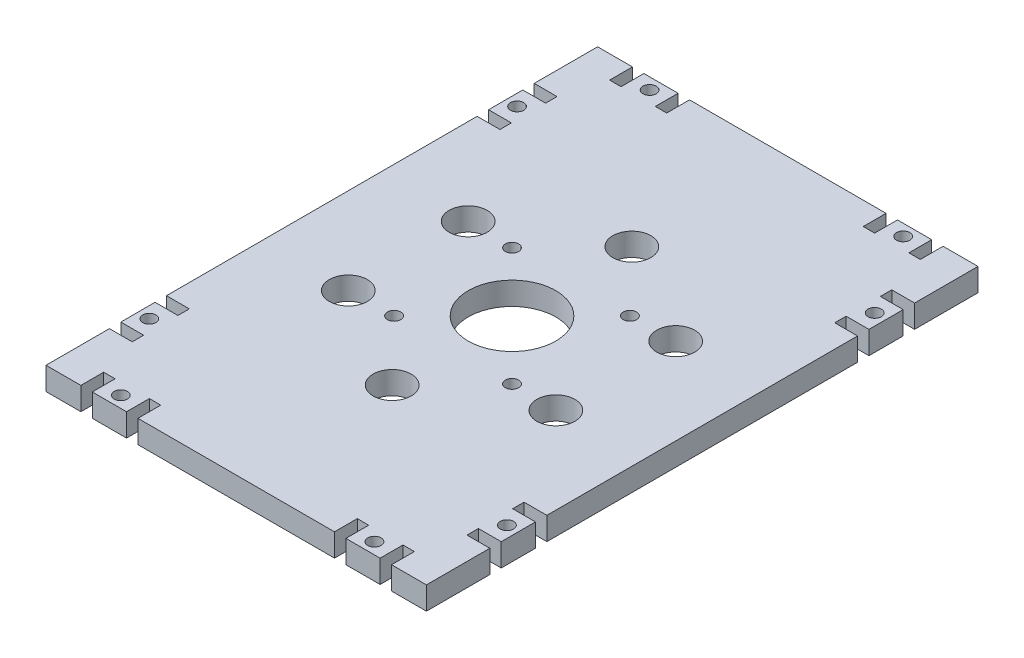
SolidWorks part; units mm, degrees
ref_plane "Front Plane" through (0, 0, 0) normal (0, 0, 1) x (1, 0, 0)
ref_plane "Top Plane" through (0, 0, 0) normal (0, 1, 0) x (1, 0, 0)
ref_plane "Right Plane" through (0, 0, 0) normal (1, 0, 0) x (0, 0, -1)
sketch "Sketch1" plane through (0, 0, 0) normal (0, 1, 0) x (1, 0, 0)
  line L1 (-50, -72.5) -> (50, -72.5)
  line L2 (-50, -72.5) -> (-50, 72.5)
  line L3 (-50, 72.5) -> (50, 72.5)
  line L4 (50, -72.5) -> (50, 72.5)
  line L5 (-50, -72.5) -> (50, 72.5) construction
  line L6 (-50, 72.5) -> (50, -72.5) construction
  point P0 (0, 0)
  dimension "D1" = 100
  dimension "D2" = 145
extrude "Boss-Extrude1" add sketch "Sketch1" along normal blind 6
sketch "Sketch2" plane through (0, 6, 0) normal (0, 1, 0) x (1, 0, 0)
  line L0 (50, 69.5) -> (-50, 69.5) construction
  line L1 (-50, -69.5) -> (50, -69.5) construction
  line L2 (-47, 72.5) -> (-47, -72.5) construction
  line L3 (50, 66.5) -> (-50, 66.5) construction
  line L4 (47, -72.5) -> (47, 72.5) construction
  line L5 (-44, 72.5) -> (-44, -72.5) construction
  line L6 (44, -72.5) -> (44, 72.5) construction
  line L7 (-50, -66.5) -> (50, -66.5) construction
  line L12 (50, -72.5) -> (50, 72.5)
  line L13 (50, 72.5) -> (-50, 72.5)
  line L14 (-50, 72.5) -> (-50, -72.5)
  line L15 (-50, -72.5) -> (50, -72.5)
  line L16 (50, -72.5) -> (50, 72.5) construction
  line L17 (50, 72.5) -> (-50, 72.5) construction
  line L18 (-50, 72.5) -> (-50, -72.5) construction
  line L19 (-50, -72.5) -> (50, -72.5) construction
  line L21 (-50, 55.8333) -> (-44, 55.8333)
  line L22 (-50, 55.8333) -> (-50, 52.8333)
  line L23 (-50, 52.8333) -> (-44, 52.8333)
  line L24 (-44, 55.8333) -> (-44, 52.8333)
  line L25 (-33.3333, 69.5) -> (-33.3333, 66.5) construction
  line L26 (-40.8333, 66.5) -> (-37.8333, 66.5)
  line L27 (-40.8333, 66.5) -> (-40.8333, 72.5)
  line L28 (-40.8333, 72.5) -> (-37.8333, 72.5)
  line L29 (-37.8333, 66.5) -> (-37.8333, 72.5)
  line L30 (-47, 48.3333) -> (-44, 48.3333) construction
  line L31 (0, 72.5) -> (0, 0) construction
  line L32 (0, 0) -> (-50, 0) construction
  line L33 (-25.8333, 72.5) -> (-28.8333, 72.5)
  line L34 (-28.8333, 66.5) -> (-28.8333, 72.5)
  line L35 (-25.8333, 66.5) -> (-28.8333, 66.5)
  line L36 (-25.8333, 66.5) -> (-25.8333, 72.5)
  line L37 (-50, 43.8333) -> (-44, 43.8333)
  line L38 (-44, 40.8333) -> (-44, 43.8333)
  line L39 (-50, 40.8333) -> (-44, 40.8333)
  line L40 (-50, 40.8333) -> (-50, 43.8333)
  line L41 (50, 40.8333) -> (50, 43.8333)
  line L42 (50, 40.8333) -> (44, 40.8333)
  line L43 (44, 40.8333) -> (44, 43.8333)
  line L44 (50, 43.8333) -> (44, 43.8333)
  line L45 (50, 52.8333) -> (44, 52.8333)
  line L46 (44, 55.8333) -> (44, 52.8333)
  line L47 (50, 55.8333) -> (44, 55.8333)
  line L48 (50, 55.8333) -> (50, 52.8333)
  line L49 (40.8333, 72.5) -> (37.8333, 72.5)
  line L50 (37.8333, 66.5) -> (37.8333, 72.5)
  line L51 (40.8333, 66.5) -> (37.8333, 66.5)
  line L52 (40.8333, 66.5) -> (40.8333, 72.5)
  line L53 (25.8333, 66.5) -> (25.8333, 72.5)
  line L54 (25.8333, 66.5) -> (28.8333, 66.5)
  line L55 (28.8333, 66.5) -> (28.8333, 72.5)
  line L56 (25.8333, 72.5) -> (28.8333, 72.5)
  line L57 (50, -40.8333) -> (44, -40.8333)
  line L58 (44, -40.8333) -> (44, -43.8333)
  line L59 (50, -43.8333) -> (44, -43.8333)
  line L60 (50, -40.8333) -> (50, -43.8333)
  line L61 (50, -55.8333) -> (50, -52.8333)
  line L62 (50, -55.8333) -> (44, -55.8333)
  line L63 (44, -55.8333) -> (44, -52.8333)
  line L64 (50, -52.8333) -> (44, -52.8333)
  line L65 (40.8333, -66.5) -> (40.8333, -72.5)
  line L66 (40.8333, -66.5) -> (37.8333, -66.5)
  line L67 (37.8333, -66.5) -> (37.8333, -72.5)
  line L68 (40.8333, -72.5) -> (37.8333, -72.5)
  line L69 (25.8333, -66.5) -> (28.8333, -66.5)
  line L70 (28.8333, -66.5) -> (28.8333, -72.5)
  line L71 (25.8333, -72.5) -> (28.8333, -72.5)
  line L72 (25.8333, -66.5) -> (25.8333, -72.5)
  line L73 (-50, -40.8333) -> (-50, -43.8333)
  line L74 (-50, -40.8333) -> (-44, -40.8333)
  line L75 (-44, -40.8333) -> (-44, -43.8333)
  line L76 (-50, -43.8333) -> (-44, -43.8333)
  line L77 (-50, -52.8333) -> (-44, -52.8333)
  line L78 (-44, -55.8333) -> (-44, -52.8333)
  line L79 (-50, -55.8333) -> (-44, -55.8333)
  line L80 (-50, -55.8333) -> (-50, -52.8333)
  line L81 (-40.8333, -72.5) -> (-37.8333, -72.5)
  line L82 (-37.8333, -66.5) -> (-37.8333, -72.5)
  line L83 (-40.8333, -66.5) -> (-37.8333, -66.5)
  line L84 (-40.8333, -66.5) -> (-40.8333, -72.5)
  line L85 (-25.8333, -66.5) -> (-25.8333, -72.5)
  line L86 (-25.8333, -66.5) -> (-28.8333, -66.5)
  line L87 (-28.8333, -66.5) -> (-28.8333, -72.5)
  line L88 (-25.8333, -72.5) -> (-28.8333, -72.5)
  circle A0 centre (-33.3333, 69.5) radius 1.75
  circle A1 centre (-47, 48.3333) radius 1.75
  circle A2 centre (47, 48.3333) radius 1.75
  circle A3 centre (33.3333, 69.5) radius 1.75
  circle A4 centre (47, -48.3333) radius 1.75
  circle A5 centre (33.3333, -69.5) radius 1.75
  circle A6 centre (-47, -48.3333) radius 1.75
  circle A7 centre (-33.3333, -69.5) radius 1.75
  point P38 (-39.3333, 66.5)
  point P39 (-44, 54.3333)
extrude "Cut-Extrude1" cut sketch "Sketch2" against normal through all
sketch "Sketch3" plane through (0, 6, 0) normal (0, 1, 0) x (1, 0, 0)
  line L2 (-15.5, -15.5) -> (15.5, -15.5) construction
  line L3 (-15.5, -15.5) -> (-15.5, 15.5) construction
  line L4 (-15.5, 15.5) -> (15.5, 15.5) construction
  line L5 (15.5, -15.5) -> (15.5, 15.5) construction
  line L6 (-15.5, -15.5) -> (15.5, 15.5) construction
  line L7 (-15.5, 15.5) -> (15.5, -15.5) construction
  circle A0 centre (0, 0) radius 11.5
  circle A1 centre (15.5, 15.5) radius 1.75
  circle A2 centre (-15.5, 15.5) radius 1.75
  circle A3 centre (-15.5, -15.5) radius 1.75
  circle A4 centre (15.5, -15.5) radius 1.75
  dimension "D1" = 31
  dimension "D2" = 23
  dimension "D4" = 3.5
extrude "Cut-Extrude2" cut sketch "Sketch3" against normal through all
sketch "Sketch4" plane through (0, 0, 0) normal (1, 0, 0) x (0, 0, -1)
  line L0 (-35, 7.7916) -> (-35, 0) construction
  line L1 (-40.8333, 0) -> (40.8333, 0) construction
  line L2 (-40.8333, 6) -> (40.8333, 6) construction
  line L3 (-40.5, 7.7916) -> (-29.5, 7.7916) construction
  circle A0 centre (-35, 7.7916) radius 5.5
  point P2 (-35, 13.2916)
  point P11 (-40.2, 6)
  point P12 (-29.8, 6)
  dimension "D1" = 11
  dimension "D2" = 35
  dimension "D3" = 10.4
  dimension "D4" = 7.2916
  dimension "D5" = 11
sketch "Sketch5" plane through (0, 6, 0) normal (0, 1, 0) x (1, 0, 0)
  circle A0 centre (0, 0) radius 31.5 construction
  circle A1 centre (0, 31.5) radius 5
  circle A2 centre (0, 0) radius 31.5 construction
  circle A3 centre (27.2798, 15.75) radius 5
  circle A4 centre (0, 0) radius 31.5 construction
  circle A5 centre (27.2798, -15.75) radius 5
  circle A6 centre (0, 0) radius 31.5 construction
  circle A7 centre (0, -31.5) radius 5
  circle A9 centre (-27.2798, -15.75) radius 5
  circle A10 centre (0, 0) radius 31.5 construction
  circle A11 centre (-27.2798, 15.75) radius 5
  circle A12 centre (0, 0) radius 31.5
  point P22 (0, 0)
  dimension "D1" = 63
  dimension "D2" = 10
  dimension "D3" = 6
extrude "Cut-Extrude3" cut sketch "Sketch5" against normal through all
equation "\"D14@Sketch2\"=(\"D12@Sketch2\"/3)/2"
equation "\"D16@Sketch2\"=\"D15@Sketch2\""
equation "\"D17@Sketch2\"=(\"D13@Sketch2\"/3)/2"
